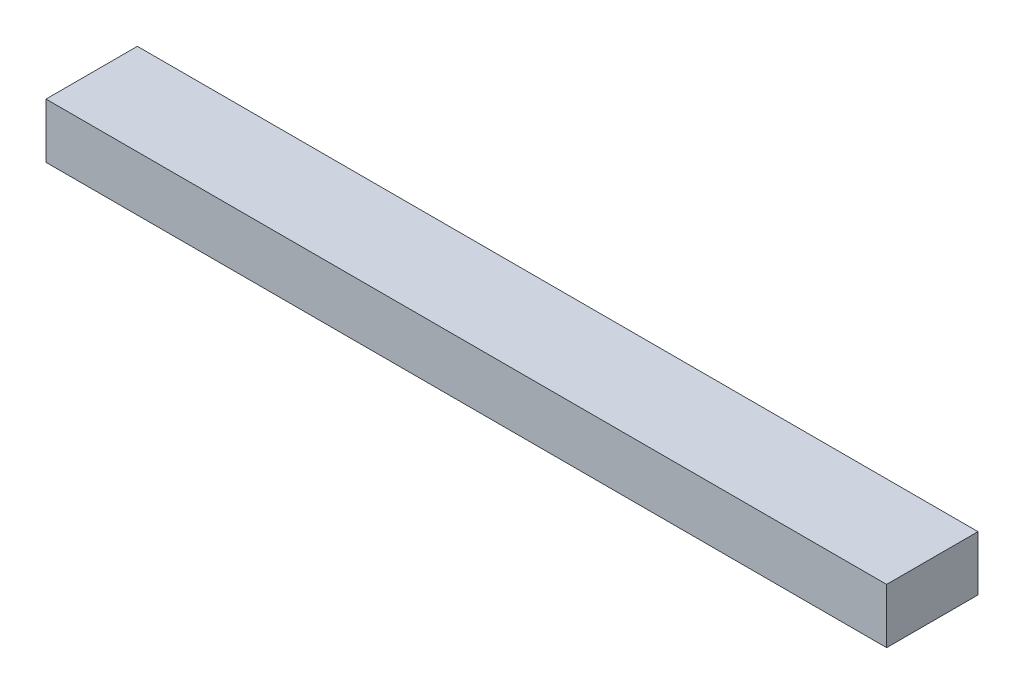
SolidWorks part; units mm, degrees
ref_plane "Front Plane" through (0, 0, 0) normal (0, 0, 1) x (1, 0, 0)
ref_plane "Top Plane" through (0, 0, 0) normal (0, 1, 0) x (1, 0, 0)
ref_plane "Right Plane" through (0, 0, 0) normal (1, 0, 0) x (0, 0, -1)
sketch "Sketch1" plane through (0, 0, 0) normal (0, 1, 0) x (1, 0, 0)
  line L1 (46, -5) -> (-46, -5)
  line L2 (46, -5) -> (46, 5)
  line L3 (46, 5) -> (-46, 5)
  line L4 (-46, -5) -> (-46, 5)
  line L5 (46, -5) -> (-46, 5) construction
  line L6 (46, 5) -> (-46, -5) construction
  point P0 (0, 0)
  dimension "D1" = 92
  dimension "D2" = 10
extrude "Boss-Extrude1" add sketch "Sketch1" along normal blind 6
